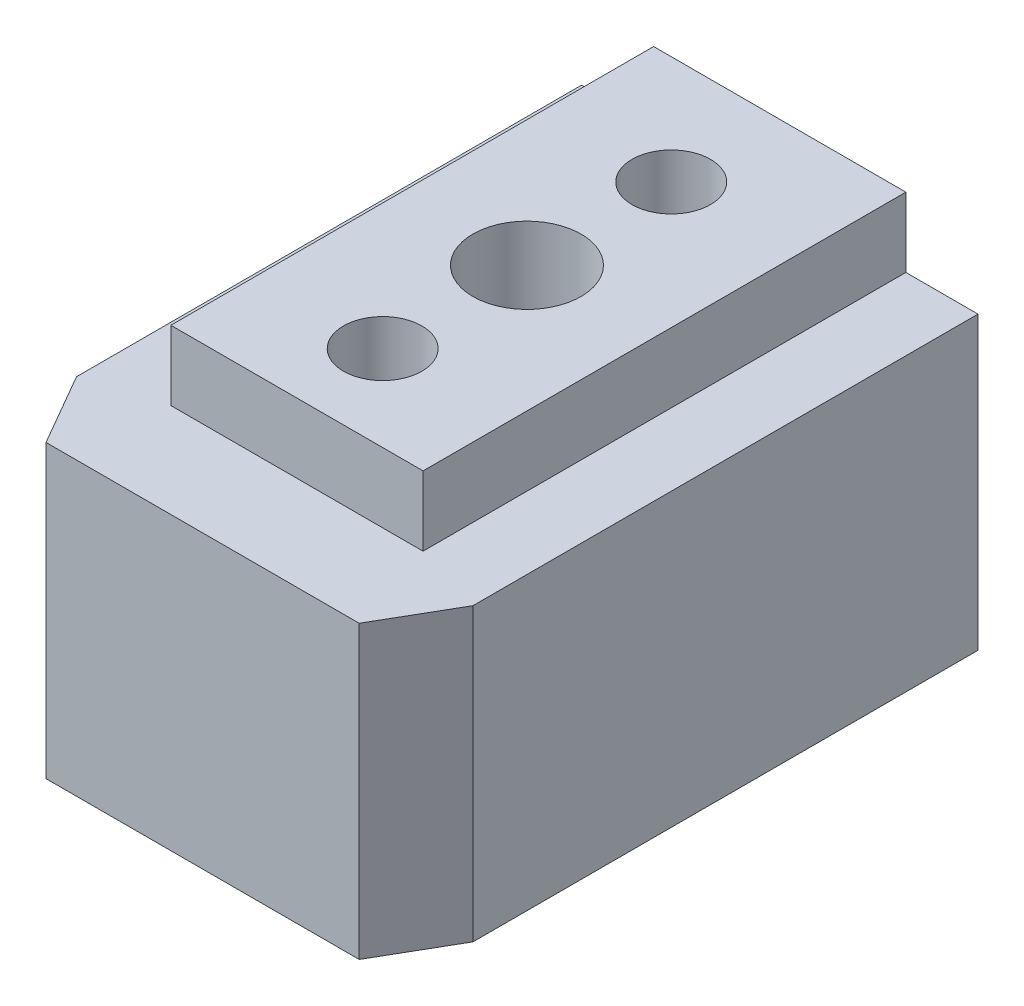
SolidWorks part; units mm, degrees
ref_plane "Front/Back" through (0, 0, 0) normal (0, 0, 1) x (1, 0, 0)
ref_plane "Top/Bottom" through (0, 0, 0) normal (0, 1, 0) x (1, 0, 0)
ref_plane "Right/Left" through (0, 0, 0) normal (1, 0, 0) x (0, 0, -1)
sketch "Sketch1" plane through (0, 0, 0) normal (0, 1, 0) x (1, 0, 0)
  line L0 (0, 0) -> (8.7249, 0) construction
  line L1 (-8.7249, 12.7) -> (8.7249, 12.7)
  line L2 (-8.7249, 12.7) -> (-8.7249, -12.7)
  line L3 (-8.7249, -12.7) -> (8.7249, -12.7)
  line L4 (8.7249, 12.7) -> (8.7249, -12.7)
  line L5 (0, 0) -> (0, 12.7) construction
  dimension "D1" = 17.4498
  dimension "D2" = 25.4
extrude "Extrude1" add sketch "Sketch1" along normal mid plane 12.8143
sketch "Sketch2" plane through (0, 6.4071, 0) normal (0, 1, 0) x (-1, 0, 0)
  line L0 (-8.7249, -12.7) -> (8.7249, -12.7) construction
  line L1 (-5.5499, -12.7) -> (5.5499, -12.7)
  line L2 (-5.5499, -12.7) -> (-5.5499, 8.5471)
  line L3 (-5.5499, 8.5471) -> (5.5499, 8.5471)
  line L4 (5.5499, -12.7) -> (5.5499, 8.5471)
  line L5 (0, 0) -> (0, 13.6166) construction
  line L6 (0, 0) -> (8.6765, 0) construction
  dimension "D1" = 21.2471
  dimension "D2" = 11.0998
extrude "Extrude2" add sketch "Sketch2" along normal blind 3.0607
chamfer "Chamfer2" distance 3.175 angle 30 1 edges at (8.7249, 0, 12.7)
chamfer "Chamfer3" distance 3.175 angle 30 1 edges at (-8.7249, 0, 12.7)
hole_wizard "#8-32 (Finger Mount Holes)" positions "Sketch4" profile "Sketch3" tap size "#8-32" standard "Ansi Inch"
sketch "Sketch4" plane through (0, 9.4679, 0) normal (0, 1, 0) x (-1, 0, 0)
  line L0 (0, 0) -> (9.3919, 0) construction
  line L1 (0, 0) -> (0, 13.5532) construction
  line L2 (-5.5499, -12.7) -> (5.5499, -12.7) construction
  point P0 (0, 4.7752)
  point P1 (0, -7.9248)
  dimension "D1" = 4.7752
  dimension "D2" = 12.7
sketch "Sketch3" plane through (0, 9.4679, 4.7752) normal (1, 0, 0) x (0, 0, 1)
  line L0 (0, 0) -> (0, 13.3314)
  line L1 (0, 13.3314) -> (1.7272, 12.2936)
  line L2 (1.7272, 12.2936) -> (1.7272, 0)
  line L5 (1.7272, 0) -> (0, 0)
  line L10 (0, 13.3314) -> (-1.7272, 12.2936) construction
  line L11 (0, -6.35) -> (0, 107.95) construction
  dimension "Tap Drill Dia." = 3.4544
  dimension "Tap Drill Depth" = 12.2936
  dimension "Drill Angle" = 118
sketch "Sketch5" plane through (0, 9.4679, 0) normal (0, 1, 0) x (-1, 0, 0)
  line L0 (0, 0) -> (0, -13.5997) construction
  line L1 (0, 0) -> (9.4849, 0) construction
  line L2 (5.5499, -12.7) -> (8.7249, -12.7) construction
  circle A0 centre (0, -1.5748) radius 2.3813
  dimension "D1" = 4.7625
  dimension "D2" = 11.1252
extrude "(3/16 Dowel Hole - Slip Fit)" cut sketch "Sketch5" against normal blind 9.525
hole_wizard "#8-32 (Finger Mount Holes )" positions "Sketch8" profile "Sketch7" tap size "#8-32" standard "Ansi Inch"
sketch "Sketch8" plane through (0, 0, -12.7) normal (0, 0, -1) x (-1, 0, 0)
  line L0 (0, 0) -> (9.3053, 0) construction
  line L1 (0, 0) -> (0, 8.4854) construction
  line L2 (0, -2.8257) -> (0, 9.4679) construction
  line L4 (-5.5499, 9.4679) -> (5.5499, 9.4679) construction
  point P0 (-5.555, 3.1179)
  point P1 (5.555, 3.1179)
  dimension "D1" = 11.11
  dimension "D2" = 6.35
sketch "Sketch7" plane through (5.555, 3.1179, -12.7) normal (1, 0, 0) x (0, 1, 0)
  line L0 (0, 0) -> (0, 13.3318)
  line L1 (0, 13.3318) -> (1.7272, 12.294)
  line L2 (1.7272, 12.294) -> (1.7272, 0)
  line L5 (1.7272, 0) -> (0, 0)
  line L10 (0, 13.3318) -> (-1.7272, 12.294) construction
  line L11 (0, -6.35) -> (0, 107.95) construction
  dimension "Tap Drill Dia." = 3.4544
  dimension "Tap Drill Depth" = 12.294
  dimension "Drill Angle" = 118
sketch "Sketch9" plane through (0, 0, -12.7) normal (0, 0, -1) x (-1, 0, 0)
  line L0 (0, 0) -> (9.1051, 0) construction
  line L1 (0, 0) -> (0, 8.4354) construction
  line L2 (0, -2.8257) -> (0, 9.4679) construction
  line L4 (-5.5499, 9.4679) -> (5.5499, 9.4679) construction
  circle A0 centre (-5.555, -3.2321) radius 1.5875
  circle A1 centre (5.555, -3.2321) radius 1.5875
  dimension "D1" = 3.175
  dimension "D2" = 11.11
  dimension "D3" = 12.7
extrude "(1/8 Dowel Holes - Slip Fit)" cut sketch "Sketch9" against normal blind 9.525
